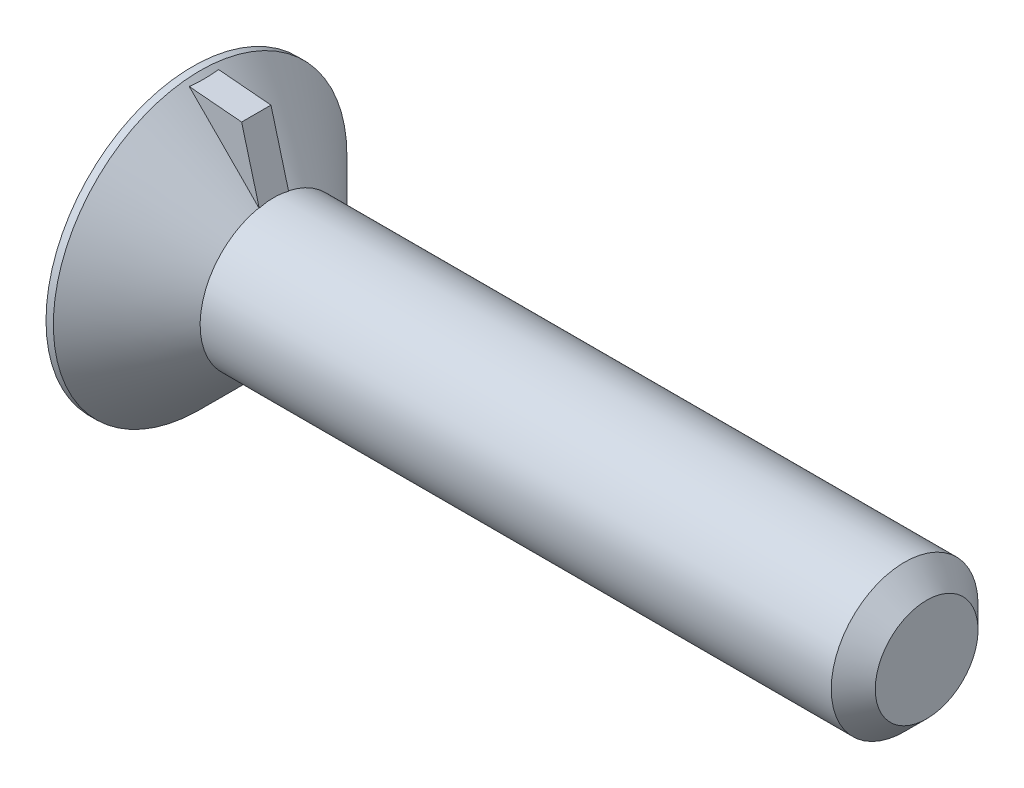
SolidWorks part; units mm, degrees
ref_plane "Front Plane" through (0, 0, 0) normal (0, 0, 1) x (1, 0, 0)
ref_plane "Top Plane" through (0, 0, 0) normal (0, 1, 0) x (1, 0, 0)
ref_plane "Right Plane" through (0, 0, 0) normal (1, 0, 0) x (0, 0, -1)
sketch "BaseBodySke" plane through (0, 0, 0) normal (0, 0, 1) x (1, 0, 0)
  line L0 (-107.4075, 0) -> (214.0904, 0) construction
  line L1 (0, 0) -> (0, 10)
  line L2 (0, 10) -> (0.5, 10)
  line L3 (0.5, 10) -> (5.5, 5)
  line L4 (5.5, 5) -> (50, 5)
  line L5 (50, 5) -> (50, 0)
  line L6 (50, 0) -> (0, 0)
  line L7 (24, 10) -> (24, -17.9005) construction
  line L8 (34.0602, 4.3095) -> (57.5082, 4.3095) construction
  line L9 (48.75, 13.8049) -> (48.75, -14.5195) construction
  dimension "Thickness" = 0.5
  dimension "Head_height" = 5.5
  dimension "Head_diameter" = 20
  dimension "Diameter" = 10
  dimension "Length" = 50
  dimension "Thread_length" = 26
  dimension "Minor_dia" = 8.619
  dimension "Advance" = 1.25
revolve "BaseBody" add sketch "BaseBodySke" angle 360 about L6
sketch "FlatEndSke" plane through (0, 0, 0) normal (0, 0, 1) x (1, 0, 0)
  line L0 (48.5, 5) -> (50, 5)
  line L1 (50, 5) -> (50, 3.5)
  line L2 (50, 3.5) -> (48.5, 5)
  line L3 (50, -5) -> (50, 5) construction
  line L4 (50, 5) -> (5.5, 5) construction
  line L5 (0, 0) -> (89.7899, 0) construction
  dimension "D1" = 45
  dimension "Chamfer_width" = 1.5
revolve "FlatEnd" cut sketch "FlatEndSke" angle 360 about L5
sketch "CutEndSke" plane through (50, 0, 0) normal (1, 0, 0) x (0, 0, -1)
  circle A0 centre (0, 0) radius 5 construction
  circle A1 centre (0, 0) radius 5
extrude "CutEnd" [suppressed] cut sketch "CutEndSke" against normal blind 1.5
dome "RoundEnd" [suppressed] faces to dome 1 distance 1.5 parameters "D1"=1.5
sketch "ThdSchSke" plane through (0, 0, 0) normal (0, 0, 1) x (1, 0, 0)
  line L0 (0, 0) -> (89.8666, 0) construction
  line L1 (50, -27.1828) -> (50, 30.5493) construction
  line L2 (47.75, 4.3095) -> (47.3513, 5)
  line L3 (47.3513, 5) -> (47.3513, 5.7973)
  line L4 (47.3513, 5.7973) -> (48.1487, 5.7973)
  line L5 (48.1487, 5.7973) -> (48.1487, 5)
  line L6 (48.1487, 5) -> (47.75, 4.3095)
  dimension "D1" = 8.619
  dimension "Length" = 50
  dimension "Advance" = 2.25
  dimension "D2" = 10
revolve "ThreadSchematic" [suppressed] cut sketch "ThdSchSke" angle 360 about L0
pattern_linear "ThdSchPat" [suppressed] count 20 spacing 1.25 along (1, 0, 0)
sketch "KeySke" plane through (0, 0, 0) normal (0, 0, 1) x (1, 0, 0)
  line L0 (0, 9.7561) -> (0, 0)
  line L1 (0, 0) -> (6.8397, 0)
  line L2 (6.8397, 0) -> (4.327, 9.3775)
  line L3 (4.327, 9.3775) -> (0, 9.7561)
  line L4 (6.8397, 0) -> (6.8397, 17.2209) construction
  line L5 (0, 9.7561) -> (9.5811, 9.7561) construction
  dimension "D1" = 5
  dimension "D2" = 15
  dimension "D3" = 9.7561
extrude "Key" add sketch "KeySke" along normal mid plane 2
equation "\"Thread_minor@ThreadCosmetic\" = \"Minor_dia@BaseBodySke\""
equation "\"Thread_length@ThreadCosmetic\" = \"Thread_length@BaseBodySke\""
equation "\"D1@CutEnd\" = \"Chamfer_width@FlatEndSke\""
equation "\"D1@RoundEnd\" = \"Chamfer_width@FlatEndSke\""
equation "\"Length@ThdSchSke\" = \"Length@BaseBodySke\""
equation "\"Advance@ThdSchSke\" = \"Advance@BaseBodySke\" * 1.8"
equation "\"D2@ThdSchSke\" = \"Diameter@BaseBodySke\""
equation "\"D1@ThdSchSke\" = \"Minor_dia@BaseBodySke\""
equation "\"D3@ThdSchPat\" = \"Advance@BaseBodySke\""
equation "\"D1@ThdSchPat\" =  int( \"Thread_length@BaseBodySke\" / \"Advance@BaseBodySke\" ) "
equation "\"D3@KeySke\" = \"Head_diameter@BaseBodySke\" / 2.05"
equation "\"Key_thickness@Key\" = \"Diameter@BaseBodySke\"/5"
